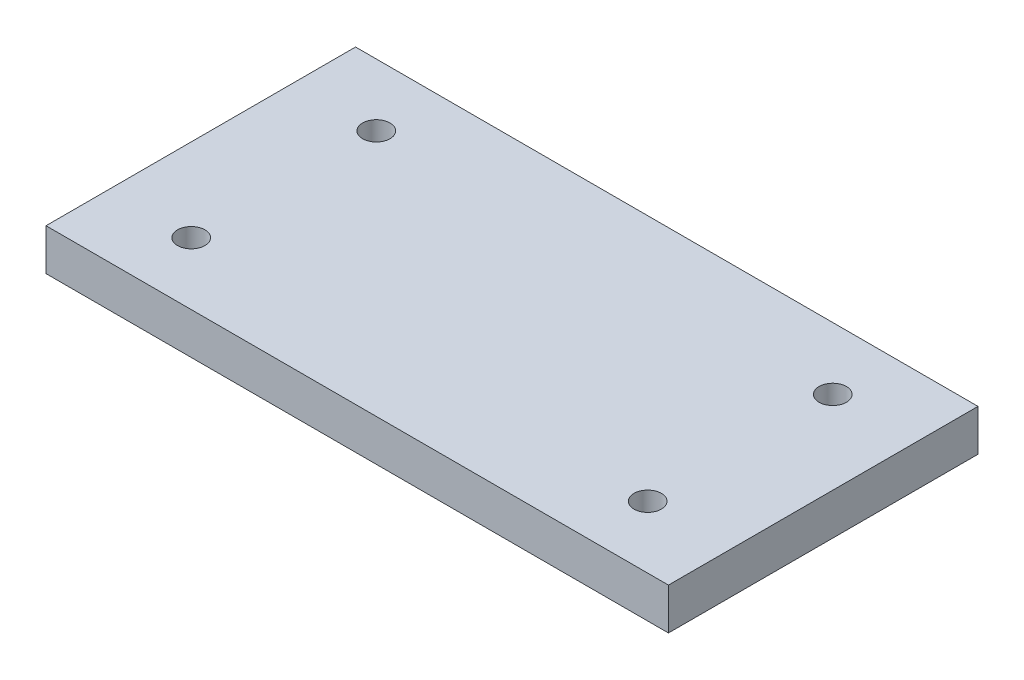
SolidWorks part; units mm, degrees
ref_plane "Alzado" through (0, 0, 0) normal (0, 0, 1) x (1, 0, 0)
ref_plane "Planta" through (0, 0, 0) normal (0, 1, 0) x (1, 0, 0)
ref_plane "Vista lateral" through (0, 0, 0) normal (1, 0, 0) x (0, 0, -1)
sketch "Croquis1" plane through (0, 0, 0) normal (0, 1, 0) x (1, 0, 0)
  line L0 (-65, -29.8) -> (-10, -29.8) construction
  line L1 (-75, 0) -> (0, 0)
  line L2 (-75, 0) -> (-75, -37.3)
  line L3 (-75, -37.3) -> (0, -37.3)
  line L4 (0, 0) -> (0, -37.3)
  line L5 (-65, -7.5) -> (-10, -7.5) construction
  circle A0 centre (-65, -7.5) radius 1.65
  circle A1 centre (-65, -29.8) radius 1.65
  circle A2 centre (-10, -7.5) radius 1.65
  circle A3 centre (-10, -29.8) radius 1.65
  dimension "D1" = 10
  dimension "D6" = 3.3
  dimension "D7" = 3.3
  dimension "D8" = 3.3
  dimension "D9" = 3.3
  dimension "D2" = 10
  dimension "D3" = 10
  dimension "D4" = 10
  dimension "D5" = 37.3
  dimension "D10" = 7.5
  dimension "D11" = 7.5
  dimension "D12" = 75
extrude "Saliente-Extruir1" add sketch "Croquis1" along normal blind 5
